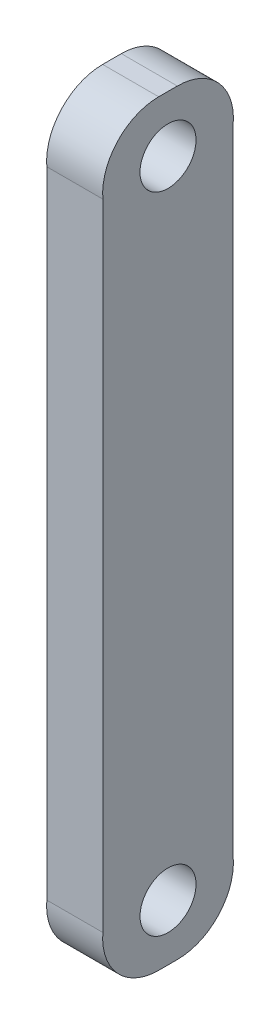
SolidWorks part; units mm, degrees
ref_plane "Front Plane" through (0, 0, 0) normal (0, 0, 1) x (1, 0, 0)
ref_plane "Top Plane" through (0, 0, 0) normal (0, 1, 0) x (1, 0, 0)
ref_plane "Right Plane" through (0, 0, 0) normal (1, 0, 0) x (0, 0, -1)
sketch "Sketch1" plane through (0, 0, 0) normal (1, 0, 0) x (0, 0, -1)
  line L0 (0, 0) -> (0.5, 0) construction
  line L1 (0, 0) -> (-0.5, 0) construction
  line L2 (-0.5, -3) -> (0.5, -3)
  line L3 (3.4895, 0.2509) -> (3.4895, 34.2509)
  line L4 (-3.4895, 0.2509) -> (-3.4895, 34.2509)
  line L5 (-3.4895, 17.2509) -> (3.4895, 17.2509) construction
  line L6 (-0.5, 37.5018) -> (0.5, 37.5018)
  circle A0 centre (0, 0) radius 1.5
  arc A1 (0.5, -3) -> (3.4895, 0.2509) centre (0.5, 0) ccw
  arc A2 (-3.4895, 0.2509) -> (-0.5, -3) centre (-0.5, 0) ccw
  circle A3 centre (0, 34.5018) radius 1.5
  arc A4 (0.5, 37.5018) -> (3.4895, 34.2509) centre (0.5, 34.5018) cw
  arc A5 (-3.4895, 34.2509) -> (-0.5, 37.5018) centre (-0.5, 34.5018) cw
  dimension "D1" = 3
  dimension "D3" = 6
  dimension "D5" = 6
  dimension "D2" = 0.5
  dimension "D4" = 0.5
  dimension "D6" = 34
  dimension "D7" = 34
extrude "Boss-Extrude1" add sketch "Sketch1" along normal blind 3
